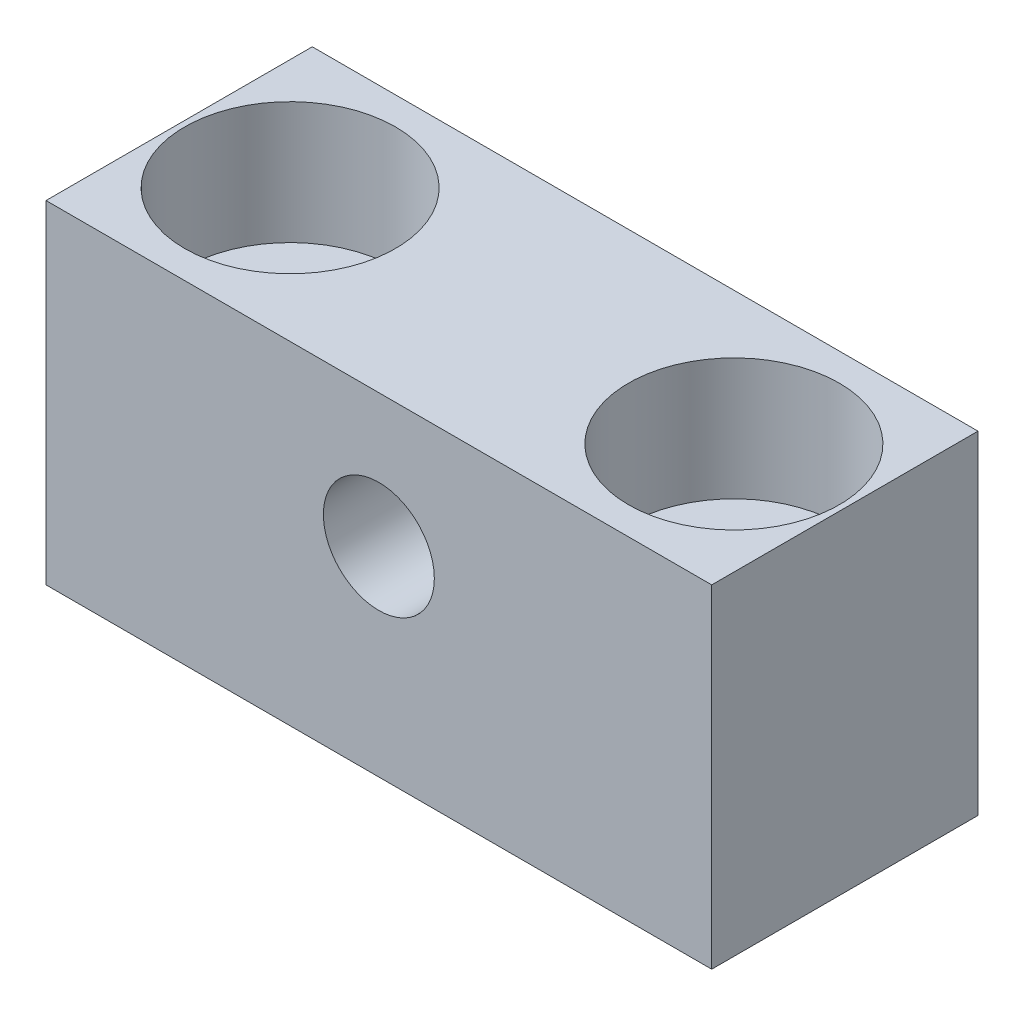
SolidWorks part; units mm, degrees
ref_plane "前视基准面" through (0, 0, 0) normal (0, 0, 1) x (1, 0, 0)
ref_plane "上视基准面" through (0, 0, 0) normal (0, 1, 0) x (1, 0, 0)
ref_plane "右视基准面" through (0, 0, 0) normal (1, 0, 0) x (0, 0, -1)
sketch "草图1" plane through (0, 0, 0) normal (0, 0, 1) x (1, 0, 0)
  line L0 (0, 15) -> (30, 15)
  line L1 (0, 0) -> (30, 0)
  line L2 (30, 0) -> (30, 15)
  line L3 (0, 0) -> (0, 15)
  circle A0 centre (15, 9) radius 2.5
extrude "凸台-拉伸1" add sketch "草图1" along normal blind 12
sketch "草图2" plane through (0, 15, 0) normal (0, 1, 0) x (1, 0, 0)
  circle A0 centre (25, -6) radius 2.75
  circle A1 centre (5, -6) radius 2.75
extrude "切除-拉伸1" cut sketch "草图2" against normal up to next
sketch "草图3" plane through (0, 15, 0) normal (0, 1, 0) x (1, 0, 0)
  circle A0 centre (25, -6) radius 4.75
  circle A1 centre (5, -6) radius 4.75
extrude "切除-拉伸2" cut sketch "草图3" against normal blind 5.5
